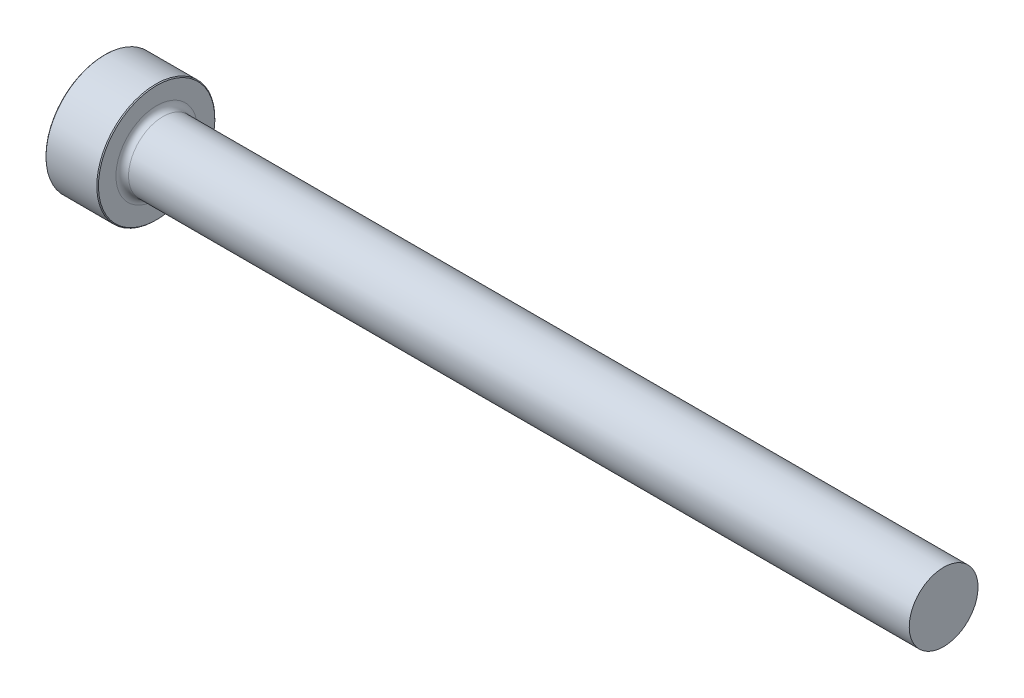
SolidWorks part; units mm, degrees
ref_plane "Front Plane" through (0, 0, 0) normal (0, 0, 1) x (1, 0, 0)
ref_plane "Top Plane" through (0, 0, 0) normal (0, 1, 0) x (1, 0, 0)
ref_plane "Right Plane" through (0, 0, 0) normal (1, 0, 0) x (0, 0, -1)
sketch "Sketch1" plane through (0, 0, 0) normal (0, 0, 1) x (1, 0, 0)
  line L0 (0, 0) -> (0, 7.1437)
  line L1 (0, 7.1437) -> (6.35, 7.1437)
  line L2 (6.35, 7.1437) -> (6.35, 4.9254)
  line L3 (7.112, 4.1634) -> (101.6, 4.1634)
  line L4 (101.6, 4.1634) -> (101.6, 0)
  line L5 (101.6, 0) -> (0, 0)
  line L6 (101.6, 0) -> (101.6, -4.1634) construction
  line L7 (101.6, -4.1634) -> (6.35, -4.1634) construction
  line L8 (0, 0) -> (0, -7.1437) construction
  line L9 (0, -7.1437) -> (6.35, -7.1437) construction
  line L10 (6.35, -7.1437) -> (6.35, -4.1634) construction
  arc A0 (6.35, 4.9254) -> (7.112, 4.1634) centre (7.112, 4.9254) ccw
  dimension "D4" = 0.762
  dimension "L" = 101.6
  dimension "D" = 8.3268
  dimension "H" = 14.2875
  dimension "T" = 6.35
revolve "Revolve1" add sketch "Sketch1" angle 360 about L5
chamfer "Chamfer1" distance 0.1016 angle 45 2 edges at (0, 7.1437, 0) (6.35, 7.1437, 0)
